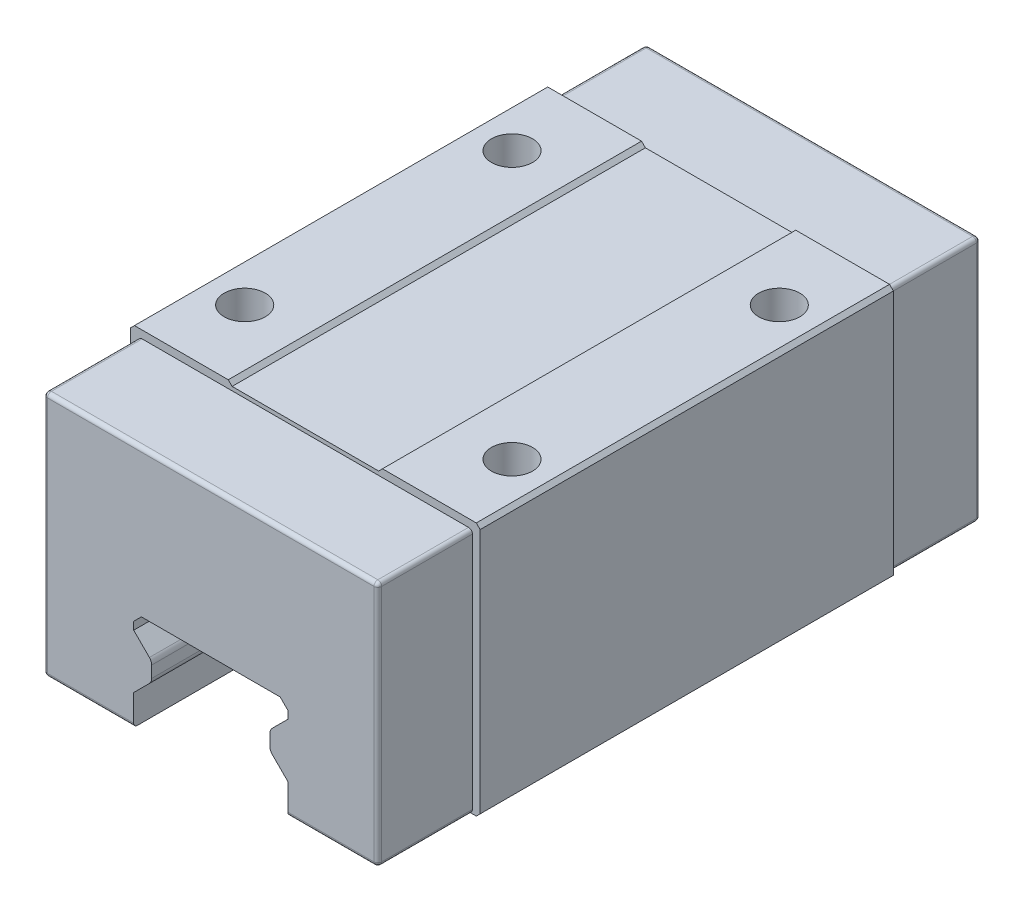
SolidWorks part; units mm, degrees
ref_plane "Front Plane" through (0, 0, 0) normal (0, 0, 1) x (1, 0, 0)
ref_plane "Top Plane" through (0, 0, 0) normal (0, 1, 0) x (1, 0, 0)
ref_plane "Right Plane" through (0, 0, 0) normal (1, 0, 0) x (0, 0, -1)
sketch "Sketch1" plane through (0, 0, 0) normal (0, 0, 1) x (1, 0, 0)
  line L1 (-17, 3.3) -> (17, 3.3)
  line L2 (-17, 3.3) -> (-17, 28)
  line L3 (-17, 28) -> (17, 28)
  line L4 (17, 3.3) -> (17, 28)
  line L5 (-17, 3.3) -> (17, 28) construction
  line L6 (-17, 28) -> (17, 3.3) construction
  point P0 (0, 15.65)
  dimension "D1" = 28
  dimension "D2" = 3.3
  dimension "D3" = 34
extrude "Boss-Extrude1" add sketch "Sketch1" along normal mid plane 40.2
sketch "Sketch2" plane through (0, 0, 0) normal (0, 0, 1) x (1, 0, 0)
  line L0 (-17, 3.3) -> (17, 3.3) construction
  line L1 (-16.25, 3.3) -> (16.25, 3.3)
  line L2 (-16.25, 3.3) -> (-16.25, 27.25)
  line L3 (-16.25, 27.25) -> (16.25, 27.25)
  line L4 (16.25, 3.3) -> (16.25, 27.25)
  line L5 (-16.25, 27.25) -> (-17, 27.25) construction
  line L6 (-17, 28) -> (-17, 3.3) construction
  line L7 (16.25, 27.25) -> (16.25, 28) construction
  line L8 (17, 28) -> (-17, 28) construction
  line L9 (16.25, 27.25) -> (17, 27.25) construction
  line L10 (17, 3.3) -> (17, 28) construction
  point P9 (0, 27.25)
  dimension "D1" = 0.75
extrude "Boss-Extrude2" add sketch "Sketch2" along normal mid plane 58.6
sketch "Sketch3" plane through (0, 0, 29.3) normal (0, 0, 1) x (1, 0, 0)
  line L1 (-7.5, 13) -> (7.5, 13)
  line L2 (-7.5, 13) -> (-7.5, 0)
  line L3 (-7.5, 0) -> (7.5, 0)
  line L4 (7.5, 13) -> (7.5, 0)
  line L5 (-7.5, 13) -> (7.5, 0) construction
  line L6 (-7.5, 0) -> (7.5, 13) construction
  point P0 (0, 6.5)
  dimension "D1" = 15
  dimension "D2" = 13
extrude "Cut-Extrude1" cut sketch "Sketch3" against normal through all
sketch "Sketch4" plane through (0, 0, 29.3) normal (0, 0, 1) x (1, 0, 0)
  line L0 (-7.5, 11.5) -> (-7.5, 6.25)
  line L1 (-7.5, 13) -> (-7.5, 3.3) construction
  line L2 (-7.5, 6.25) -> (-5.75, 8)
  line L3 (-5.75, 8) -> (-5.75, 9.75)
  line L4 (-5.75, 9.75) -> (-7.5, 11.5)
  line L5 (7.5, 13) -> (-7.5, 13) construction
  line L6 (-5.75, 9.75) -> (-7.5, 9.75) construction
  line L7 (-5.75, 8) -> (-7.5, 8) construction
  line L8 (-6.625, 9.75) -> (-6.625, 8) construction
  line L9 (0, 0) -> (0, 13) construction
  line L10 (6.625, 9.75) -> (6.625, 8) construction
  line L11 (5.75, 8) -> (7.5, 8) construction
  line L12 (5.75, 9.75) -> (7.5, 9.75) construction
  line L13 (5.75, 9.75) -> (7.5, 11.5)
  line L14 (5.75, 8) -> (5.75, 9.75)
  line L15 (7.5, 6.25) -> (5.75, 8)
  line L16 (7.5, 11.5) -> (7.5, 6.25)
extrude "Boss-Extrude3" add sketch "Sketch4" against normal up to surface (58.6 mm away)
chamfer "Chamfer1" distance 0.75 angle 45 2 edges at (7.5, 13, 0) (-7.5, 13, 0)
fillet "Fillet1" radius 0.75 4 edges at (5.75, 8, 0) (5.75, 9.75, 0) (-5.75, 8, 0) (-5.75, 9.75, 0)
sketch "Sketch5" plane through (0, 0, 20.1) normal (0, 0, 1) x (1, 0, 0)
  line L0 (17, 28) -> (-17, 28) construction
  line L1 (-7.5, 28) -> (7.5, 28)
  line L2 (-7.5, 28) -> (-7.5, 27.625)
  line L3 (-7.5, 27.625) -> (7.5, 27.625)
  line L4 (7.5, 28) -> (7.5, 27.625)
  point P6 (0, 27.625)
  dimension "D1" = 15
  dimension "D2" = 0.375
extrude "Cut-Extrude2" cut sketch "Sketch5" against normal through all
chamfer "Chamfer2" distance 0.375 angle 45 6 edges at (17, 28, 0) (17, 3.3, 0) (-17, 3.3, 0) (-17, 28, 0) (7.5, 27.625, 0) (-7.5, 27.625, 0)
fillet "Fillet2" radius 0.375 18 edges at (-16.25, 3.3, -24.7) (11.875, 3.3, -29.3) (-16.25, 3.3, 24.7) (-11.875, 3.3, -29.3) (-11.875, 3.3, 29.3) (11.875, 3.3, 29.3) (16.25, 3.3, 24.7) (-16.25, 15.275, 29.3) (-16.25, 15.275, -29.3) (-16.25, 27.25, 24.7) (16.25, 27.25, 24.7) (16.25, 15.275, 29.3) (16.25, 15.275, -29.3) (0, 27.25, 29.3) (0, 27.25, -29.3) (16.25, 3.3, -24.7) (16.25, 27.25, -24.7) (-16.25, 27.25, -24.7)
sketch "Sketch6" plane through (0, 28, 0) normal (0, 1, 0) x (1, 0, 0)
  line L0 (-13, 13) -> (0, 0) construction
  line L1 (0, 0) -> (13, -13) construction
  line L2 (13, 13) -> (0, 0) construction
  line L3 (0, 0) -> (-13, -13) construction
  circle A0 centre (-13, 13) radius 2
  circle A1 centre (-13, -13) radius 2
  circle A2 centre (13, -13) radius 2
  circle A3 centre (13, 13) radius 2
  dimension "D1" = 4
  dimension "D2" = 26
  dimension "D3" = 26
extrude "Cut-Extrude3" cut sketch "Sketch6" against normal blind 6
sketch "Sketch7" plane through (0, 0, 0) normal (0, 0, 1) x (1, 0, 0)
  line L0 (-16.625, 28) -> (-23.5, 28)
  line L1 (-23.5, 28) -> (-23.5, 20.5)
  line L2 (-16.625, 28) -> (-16.625, 14.375)
  line L3 (-17, 27.625) -> (-17, 3.675) construction
  line L4 (-17, 14.375) -> (-16.625, 14.375)
  line L5 (-23.5, 20.5) -> (-23.125, 20.5)
  line L6 (0, 0) -> (0, 27.625) construction
  line L7 (-7.125, 27.625) -> (7.125, 27.625) construction
  line L8 (23.5, 20.5) -> (23.125, 20.5)
  line L9 (17, 14.375) -> (16.625, 14.375)
  line L10 (16.625, 28) -> (16.625, 14.375)
  line L11 (23.5, 28) -> (23.5, 20.5)
  line L12 (16.625, 28) -> (23.5, 28)
  arc A1 (-23.125, 20.5) -> (-17, 14.375) centre (-23.125, 14.375) cw
  arc A2 (23.125, 20.5) -> (17, 14.375) centre (23.125, 14.375) ccw
  point P22 (-23.3125, 20.5)
  dimension "D1" = 47
  dimension "D2" = 7.5
  dimension "D3" = 0.375
extrude "Boss-Extrude4" [suppressed] add sketch "Sketch7" along normal mid plane 30
sketch "Sketch8" [suppressed] plane through (0, 0, 0) normal (0, 0, 1) x (1, 0, 0)
  line L5 (-35, 30) -> (-35, 40)
  line L6 (-35, 30) -> (-23.38, 30)
  line L7 (-35, 40) -> (-23.38, 40)
  line L8 (-23.38, 30) -> (-23.38, 40)
  line L9 (35, 30) -> (35, 40)
  line L10 (35, 30) -> (23.38, 30)
  line L11 (35, 40) -> (23.38, 40)
  line L13 (23.38, 40) -> (23.38, 30)
extrude "Boss-Extrude5" [suppressed] add sketch "Sketch8" along normal mid plane 40.2
chamfer "Chamfer3" [suppressed] distance 0.375 angle 45
fillet "Fillet3" [suppressed] radius 4
equation "\"D2@Sketch4\"=\"D1@Sketch4\"*3.5"
